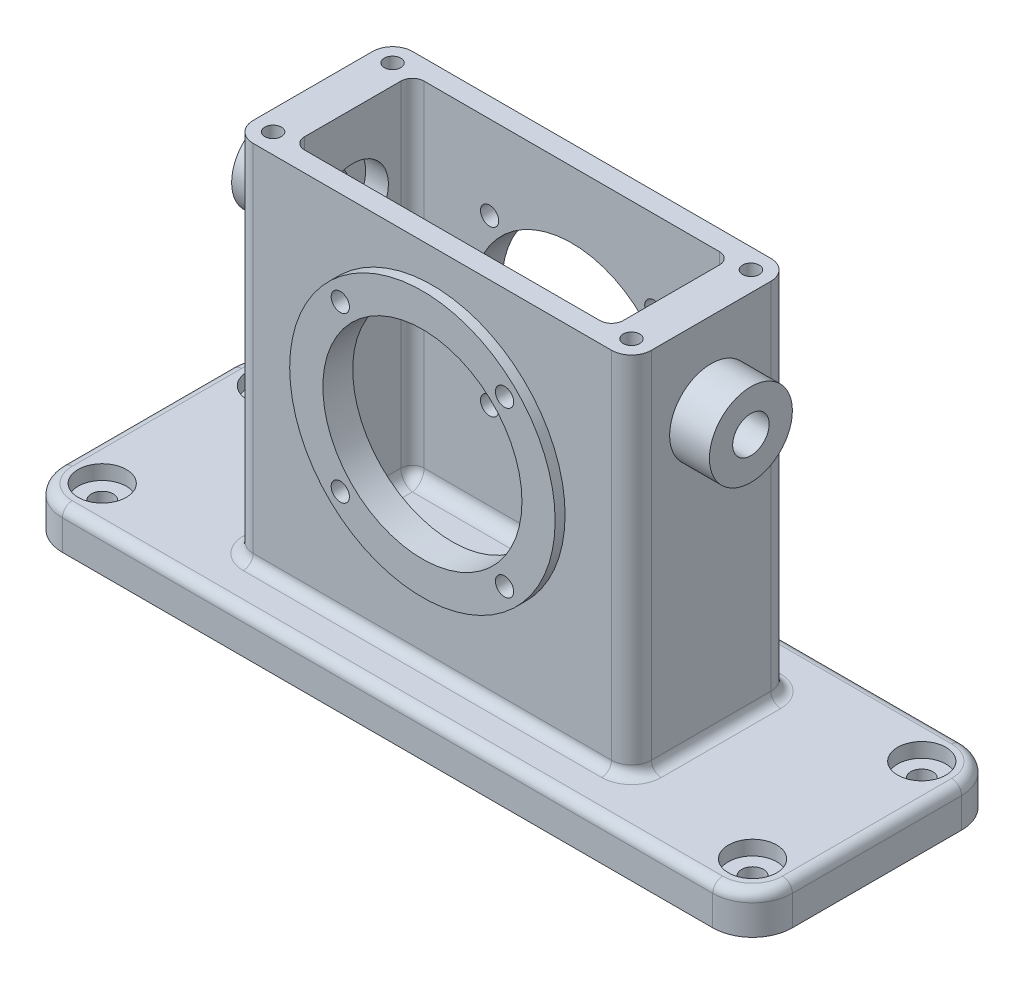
SolidWorks part; units mm, degrees
ref_plane "Front Plane" through (0, 0, 0) normal (0, 0, 1) x (1, 0, 0)
ref_plane "Top Plane" through (0, 0, 0) normal (0, 1, 0) x (1, 0, 0)
ref_plane "Right Plane" through (0, 0, 0) normal (1, 0, 0) x (0, 0, -1)
sketch "Sketch1" plane through (0, 0, 0) normal (0, 1, 0) x (1, 0, 0)
  line L1 (110, 37.5) -> (0, 37.5)
  line L2 (110, 37.5) -> (110, -37.5)
  line L3 (110, -37.5) -> (0, -37.5)
  line L4 (0, 37.5) -> (0, -37.5)
  dimension "D1" = 75
  dimension "D2" = 110
extrude "Plate" add sketch "Sketch1" along normal blind 12
sketch "Sketch2" plane through (0, 12, 0) normal (0, 1, 0) x (1, 0, 0)
  line L0 (0, -37.5) -> (0, 37.5) construction
  line L1 (0, 24) -> (60, 24)
  line L2 (0, 24) -> (0, -24)
  line L3 (0, -24) -> (60, -24)
  line L4 (60, 24) -> (60, -24)
  dimension "D1" = 60
  dimension "D2" = 48
extrude "Hsg" add sketch "Sketch2" along normal blind 110
sketch "Sketch3" plane through (60, 0, 0) normal (1, 0, 0) x (0, 0, -1)
  line L0 (0, 67.1) -> (0, -67.1) construction
  line L1 (-24, 122) -> (24, 122) construction
  circle A0 centre (0, 97) radius 12.5
  dimension "D1" = 25
  dimension "D2" = 25
extrude "Sm Cir Boss" add sketch "Sketch3" along normal blind 12
sketch "Sketch4" plane through (0, 122, 0) normal (0, 1, 0) x (1, 0, 0)
  line L0 (0, 24) -> (0, -24) construction
  line L1 (0, -18) -> (48, -18)
  line L2 (0, -18) -> (0, 18)
  line L3 (0, 18) -> (48, 18)
  line L4 (48, -18) -> (48, 18)
  line L5 (60, -24) -> (60, 24) construction
  line L6 (60, 24) -> (0, 24) construction
  line L7 (0, -24) -> (60, -24) construction
  dimension "D1" = 12
  dimension "D2" = 6
  dimension "D3" = 6
extrude "Inner Cut" cut sketch "Sketch4" against normal offset from surface (105 mm away) 5
hole_wizard "CBORE for M10 Hex Head Bolt1" positions "Sketch6" profile "Sketch5" counterbore size "M10" standard "ANSI Metric"
sketch "Sketch6" plane through (48, 0, 0) normal (-1, 0, 0) x (0, 0, 1)
  point P0 (0, 97)
sketch "Sketch5" plane through (48, 97, 0) normal (0, 1, 0) x (0, 0, 1)
  line L0 (0, 0) -> (0, 62)
  line L1 (0, 62) -> (5.5, 62)
  line L3 (5.5, 62) -> (5.5, 6.85)
  line L4 (5.5, 6.85) -> (10.74, 6.85)
  line L5 (10.74, 6.85) -> (10.74, 0)
  line L7 (10.74, 0) -> (0, 0)
  line L11 (0, -6.35) -> (0, 107.95) construction
  dimension "Thru Hole Dia." = 11
  dimension "Thru Hole Depth" = 62
  dimension "C'Bore Dia." = 21.48
  dimension "C'Bore Depth" = 6.85
fillet "Fillet1" radius 12 2 edges at (110, 6, -37.5) (110, 6, 37.5)
fillet "Fillet2" radius 3 5 edges at (49, 12, -37.5) (106.4853, 12, -33.9853) (110, 12, 0) (106.4853, 12, 33.9853) (49, 12, 37.5)
fillet "Fillet3" radius 6 2 edges at (60, 67, -24) (60, 67, 24)
fillet "Fillet4" radius 3 5 edges at (58.2426, 12, -22.2426) (60, 12, 0) (58.2426, 12, 22.2426)
fillet "Fillet5" radius 3.5 2 edges at (48, 69.5, 18) (48, 69.5, -18)
fillet "Fillet6" radius 4 5 edges at (22.25, 17, 18) (46.9749, 17, 16.9749) (48, 17, 0) (46.9749, 17, -16.9749) (22.25, 17, -18)
hole_wizard "Ø5.0 (5) Diameter Hole1" positions "Sketch8" profile "Sketch7" hole size "Ø5.0" standard "ANSI Metric"
sketch "Sketch8" plane through (0, 122, 0) normal (0, 1, 0) x (1, 0, 0)
  point P0 (54, -18)
  point P3 (54, 18)
sketch "Sketch7" plane through (54, 122, 18) normal (1, 0, 0) x (0, 0, 1)
  line L0 (0, 0) -> (0, 11.5022)
  line L1 (0, 11.5022) -> (2.5, 10)
  line L2 (2.5, 10) -> (2.5, 0)
  line L5 (2.5, 0) -> (0, 0)
  line L10 (0, 11.5022) -> (-2.5, 10) construction
  line L11 (0, -6.35) -> (0, 107.95) construction
  dimension "Hole Dia." = 5
  dimension "Hole Depth" = 10
  dimension "Drill Angle" = 118
hole_wizard "CBORE for M6 Hex Head Bolt1" positions "Sketch10" profile "Sketch9" counterbore size "M6" standard "ANSI Metric"
sketch "Sketch10" plane through (0, 12, 0) normal (0, 1, 0) x (1, 0, 0)
  point P0 (98, -25.5)
  point P3 (98, 25.5)
sketch "Sketch9" plane through (98, 12, 25.5) normal (1, 0, 0) x (0, 0, 1)
  line L0 (0, 0) -> (0, 12)
  line L1 (0, 12) -> (3.3, 12)
  line L3 (3.3, 12) -> (3.3, 4.38)
  line L4 (3.3, 4.38) -> (7.275, 4.38)
  line L5 (7.275, 4.38) -> (7.275, 0)
  line L7 (7.275, 0) -> (0, 0)
  line L11 (0, -6.35) -> (0, 107.95) construction
  dimension "Thru Hole Dia." = 6.6
  dimension "Thru Hole Depth" = 12
  dimension "C'Bore Dia." = 14.55
  dimension "C'Bore Depth" = 4.38
mirror "Mirror1" about plane through (0, 12, -37.5) normal (1, 0, 0)
sketch "Sketch11" plane through (0, 0, 24) normal (0, 0, 1) x (1, 0, 0)
  line L0 (0, -41.25) -> (0, 41.25) construction
  line L1 (-54, 122) -> (54, 122) construction
  circle A0 centre (0, 72) radius 40
  dimension "D1" = 50
  dimension "D2" = 80
extrude "Lg Cir Boss" add sketch "Sketch11" along normal blind 3
mirror "Mirror2" about plane through (0, 0, 0) normal (0, 0, 1) of "Lg Cir Boss"
sketch "Sketch12" plane through (0, 0, 27) normal (0, 0, 1) x (1, 0, 0)
  circle A0 centre (0, 72) radius 30
  dimension "D1" = 60
extrude "Lg Thru Hole" cut sketch "Sketch12" against normal through all
sketch "Sketch13" plane through (0, 0, 27) normal (0, 0, 1) x (1, 0, 0)
  circle A0 centre (0, 72) radius 35 construction
  dimension "D1" = 70
hole_wizard "Ø5.5 (5.5) Diameter Hole1" positions "Sketch15" profile "Sketch14" hole size "Ø5.5" standard "ANSI Metric"
sketch "Sketch15" plane through (0, 0, 27) normal (0, 0, 1) x (1, 0, 0)
  line L0 (0, 72) -> (35, 72) construction
  line L1 (0, 72) -> (24.7487, 96.7487) construction
  line L3 (0, 72) -> (24.7487, 47.2513) construction
  line L4 (-24.7487, 47.2513) -> (0, 72) construction
  line L5 (0, 72) -> (-24.7487, 96.7487) construction
  circle A0 centre (0, 72) radius 35 construction
  point P0 (24.7487, 96.7487)
  point P4 (24.7487, 47.2513)
  point P6 (-24.7487, 47.2513)
  point P8 (-24.7487, 96.7487)
  dimension "D1" = 45
sketch "Sketch14" plane through (24.7487, 96.7487, 27) normal (1, 0, 0) x (0, -1, 0)
  line L0 (0, 0) -> (0, 64.5)
  line L1 (0, 64.5) -> (2.75, 64.5)
  line L2 (2.75, 64.5) -> (2.75, 0)
  line L5 (2.75, 0) -> (0, 0)
  line L11 (0, -6.35) -> (0, 107.95) construction
  dimension "Thru Hole Dia." = 5.5
  dimension "Thru Hole Depth" = 64.5
